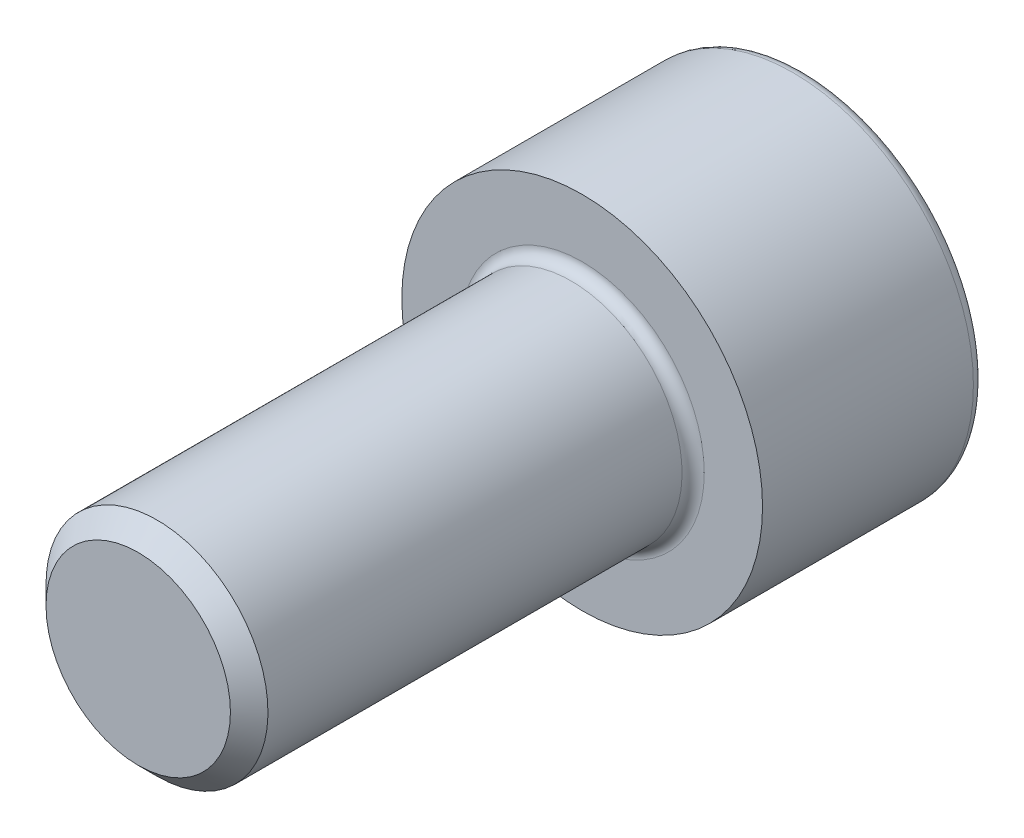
SolidWorks part; units mm, degrees
ref_plane "Plan1" through (0, 0, 0) normal (0, 0, 1) x (1, 0, 0)
ref_plane "Plan2" through (0, 0, 0) normal (0, 1, 0) x (1, 0, 0)
ref_plane "Plan3" through (0, 0, 0) normal (1, 0, 0) x (0, 0, -1)
sketch "Sketch1" plane through (0, 0, 0) normal (1, 0, 0) x (0, 0, -1)
  line L0 (8, 0) -> (-16, 0) construction
  line L1 (8, 0) -> (8, 6.5)
  line L2 (8, 6.5) -> (0, 6.5)
  line L3 (0, 6.5) -> (0, 4)
  line L4 (0, 4) -> (-16, 4)
  line L5 (-16, 4) -> (-16, 0)
  line L6 (-16, 0) -> (8, 0)
  line L7 (8, 0) -> (6.75, 0) construction
  dimension "DK" = 13
  dimension "L" = 16
  dimension "K" = 8
  dimension "D" = 8
  dimension "P" = 1.25
revolve "Base-Revolve" add sketch "Sketch1"
chamfer "Chamfer1" distance 0.6766 angle 45 1 edges at (0, 4, 16)
fillet "Fillet1" radius 0.4 2 edges at (0, 4, 0) (0, 6.5, -8)
hole_wizard "Hole1" positions "Sketch3" profile "Sketch2" legacy
sketch "Sketch3" plane through (0, 0, -8) normal (0, 0, -1) x (-1, 0, 0)
  circle A0 centre (0, 0) radius 6.5 construction
  point P0 (0, 0)
sketch "Sketch2" plane through (0, 0, -8) normal (1, 0, 0) x (0, 1, 0)
  line L0 (0, 0) -> (0, 5.7321)
  line L1 (0, 5.7321) -> (3, 4)
  line L2 (3, 4) -> (3, 0)
  line L4 (3, 0) -> (0, 0)
  line L6 (0, 5.7321) -> (-3, 4) construction
  line L7 (0, -4.2442) -> (0, 117.3081) construction
  dimension "Diameter" = 6
  dimension "Depth" = 4
  dimension "Drill Angle" = 120
sketch "Sketch4" plane through (0, 0, -8) normal (0, 0, -1) x (-1, 0, 0)
  line L0 (0, -3) -> (0, 3) construction
  line L1 (3.4641, 0) -> (-3.4641, 0) construction
  line L2 (1.7321, 3) -> (-1.7321, 3)
  line L3 (-1.7321, 3) -> (-3.4641, 0)
  line L4 (-3.4641, 0) -> (-1.7321, -3)
  line L5 (-1.7321, -3) -> (1.7321, -3)
  line L6 (1.7321, -3) -> (3.4641, 0)
  line L7 (3.4641, 0) -> (1.7321, 3)
  dimension "D1" = 120
  dimension "S" = 6
extrude "Cut-Extrude1" cut sketch "Sketch4" against normal blind 4
equation "\"K@Sketch1\" = \"D@Sketch1\""
equation "\"D1@Fillet1\" = \"D@Sketch1\"*0.05"
equation "\"S@Sketch4\" = \"Diameter@Sketch2\""
equation "\"T@Cut-Extrude1\" = \"Depth@Sketch2\""
equation "\"D1@Cosmetic_Thread1\" = \"D@Sketch1\"-(1.0825*\"P@Sketch1\")"
equation "\"D1@Chamfer1\" = (\"D@Sketch1\"-\"D1@Cosmetic_Thread1\")/2"
